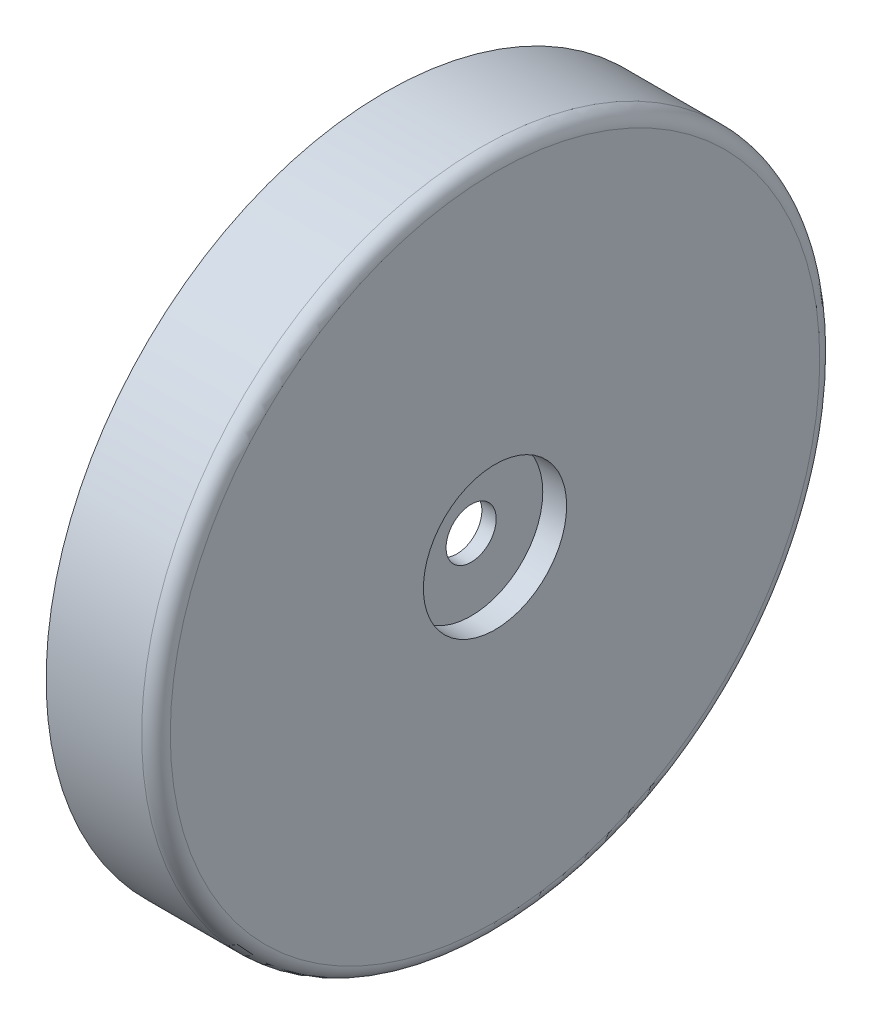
SolidWorks part; units mm, degrees
ref_plane "Plan de face" through (0, 0, 0) normal (0, 0, 1) x (1, 0, 0)
ref_plane "Plan de dessus" through (0, 0, 0) normal (0, 1, 0) x (1, 0, 0)
ref_plane "Plan de droite" through (0, 0, 0) normal (1, 0, 0) x (0, 0, -1)
sketch "Esquisse1" plane through (0, 0, 0) normal (0, 0, 1) x (1, 0, 0)
  line L0 (0, 15) -> (0, 68)
  line L1 (-3, 71) -> (-23, 71)
  line L2 (0, 15) -> (-5, 15)
  line L3 (-5, 15) -> (-5, 5.25)
  line L4 (-23, 71) -> (-23, 68)
  line L5 (-23, 68) -> (-4, 68)
  line L6 (-3, 67) -> (-3, 19)
  line L7 (-4, 18) -> (-7, 18)
  line L8 (-8, 17) -> (-8, 5.25)
  line L9 (-8, 5.25) -> (-5, 5.25)
  line L10 (0, 0) -> (-23, 0) construction
  arc A0 (-7, 18) -> (-8, 17) centre (-7, 17) ccw
  arc A1 (-3, 19) -> (-4, 18) centre (-4, 19) cw
  arc A2 (0, 68) -> (-3, 71) centre (-3, 68) ccw
  arc A3 (-4, 68) -> (-3, 67) centre (-4, 67) cw
  point P18 (0, 71)
  dimension "D10" = 1
  dimension "D11" = 1
  dimension "D12" = 3
  dimension "D13" = 1
  dimension "D1" = 71
  dimension "D2" = 23
  dimension "D3" = 5
  dimension "D4" = 3
  dimension "D5" = 3
  dimension "D6" = 3
  dimension "D7" = 3
  dimension "D8" = 5.25
  dimension "D9" = 15
revolve "Révolution1" add sketch "Esquisse1" angle 360 about L10
sketch "Esquisse2" plane through (-23, 0, 0) normal (-1, 0, 0) x (0, 0, 1)
  line L1 (-90, 22.5) -> (-40, 22.5)
  line L2 (-90, 22.5) -> (-90, -22.5)
  line L3 (-90, -22.5) -> (-40, -22.5)
  line L4 (-40, 22.5) -> (-40, -22.5)
  dimension "D1" = 22.5
  dimension "D2" = 22.5
  dimension "D3" = 50
  dimension "D4" = 40
extrude "Enlèv. mat.-Extru.1" cut sketch "Esquisse2" against normal up to surface (20 mm away)
sketch "Esquisse3" plane through (-3, 0, 0) normal (-1, 0, 0) x (0, 0, 1)
  line L0 (0, 0) -> (-78.3579, 78.3579) construction
  line L1 (0, 0) -> (-94.6386, 0) construction
  line L2 (-45.9619, 45.9619) -> (-39.1827, 52.7411) construction
  line L3 (-41.7193, 50.2046) -> (-43.6531, 52.1384)
  line L4 (-45.9619, 45.9619) -> (-52.9409, 38.983) construction
  line L5 (-50.2046, 41.7193) -> (-52.1384, 43.6531)
  arc A0 (-50.2046, 41.7193) -> (-41.7193, 50.2046) centre (-45.9619, 45.9619) ccw
  arc A4 (-64.1697, -22.5) -> (-64.1697, 22.5) centre (0, 0) ccw
  arc A5 (-43.6531, 52.1384) -> (-52.1384, 43.6531) centre (0, 0) ccw
  dimension "D2" = 12
  dimension "D1" = 45
  dimension "D3" = 65
  dimension "D5" = 90
  dimension "D6" = 90
  dimension "D4" = 0
extrude "Boss.-Extru.1" add sketch "Esquisse3" along normal blind 15
fillet "Congé1" radius 2 7 edges at (-11, 52.1384, -43.6531) (-3.3773, 51.9839, -43.4987) (-3, 50.8165, -42.3312) (-3, 41.7193, -41.7193) (-3, 42.3312, -50.8165) (-3.2964, 43.4476, -51.9329) (-11, 43.6531, -52.1384)
sketch "Esquisse4" plane through (-18, 0, 0) normal (-1, 0, 0) x (0, 0, 1)
  circle A0 centre (-45.9619, 45.9619) radius 2.75
  dimension "D1" = 5.5
extrude "Enlèv. mat.-Extru.2" cut sketch "Esquisse4" against normal blind 5
pattern_circular "Répétition circulaire1" count 13 every 22.5 about axis through (0, 0, 0) along (1, 0, 0) of "Boss.-Extru.1", "Enlèv. mat.-Extru.2", "Congé1"
